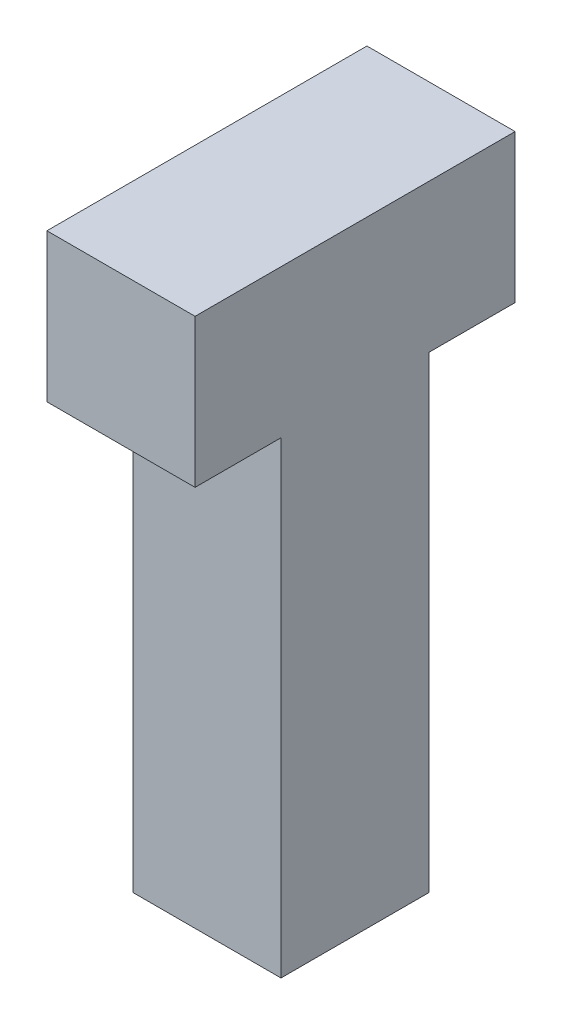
SolidWorks part; units mm, degrees
ref_plane "Front Plane" through (0, 0, 0) normal (0, 0, 1) x (1, 0, 0)
ref_plane "Top Plane" through (0, 0, 0) normal (0, 1, 0) x (1, 0, 0)
ref_plane "Right Plane" through (0, 0, 0) normal (1, 0, 0) x (0, 0, -1)
sketch "Sketch1" plane through (0, 0, 0) normal (0, 0, 1) x (1, 0, 0)
  line L1 (0, 0) -> (9.5, 0)
  line L2 (0, 0) -> (0, -9.5)
  line L3 (0, -9.5) -> (9.5, -9.5)
  line L4 (9.5, 0) -> (9.5, -9.5)
  dimension "D1" = 9.5
  dimension "D2" = 9.5
extrude "Boss-Extrude1" add sketch "Sketch1" along normal blind 20.52
sketch "Sketch2" plane through (0, -9.5, 0) normal (0, -1, 0) x (1, 0, 0)
  line L0 (0, 20.52) -> (0, 0) construction
  line L1 (0, 15.01) -> (9.5, 15.01)
  line L2 (0, 15.01) -> (0, 5.51)
  line L3 (0, 5.51) -> (9.5, 5.51)
  line L4 (9.5, 15.01) -> (9.5, 5.51)
  line L5 (9.5, 20.52) -> (9.5, 0) construction
  line L6 (0, 0) -> (9.5, 0) construction
  dimension "D1" = 9.5
  dimension "D2" = 5.51
extrude "Boss-Extrude2" add sketch "Sketch2" along normal blind 30
